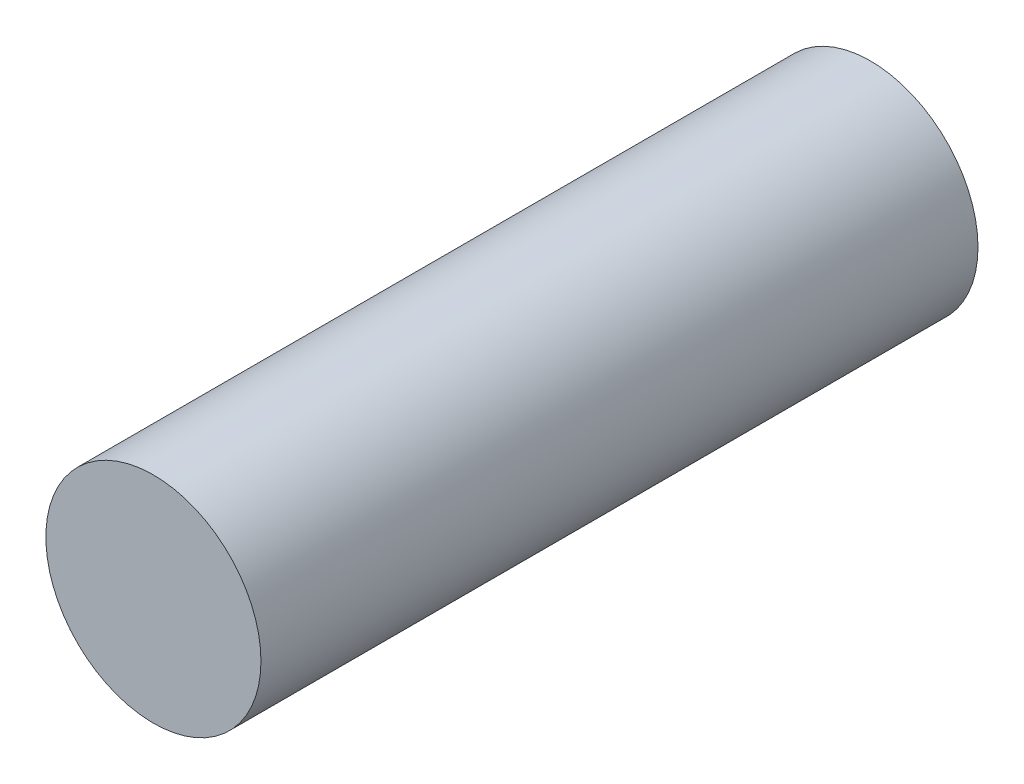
SolidWorks part; units mm, degrees
ref_plane "Front Plane" through (0, 0, 0) normal (0, 0, 1) x (1, 0, 0)
ref_plane "Top Plane" through (0, 0, 0) normal (0, 1, 0) x (1, 0, 0)
ref_plane "Right Plane" through (0, 0, 0) normal (1, 0, 0) x (0, 0, -1)
sketch "Sketch1" plane through (0, 0, 0) normal (0, 0, 1) x (1, 0, 0)
  circle A0 centre (0, 0) radius 30
  dimension "D1" = 60
extrude "Boss-Extrude1" add sketch "Sketch1" against normal blind 200
